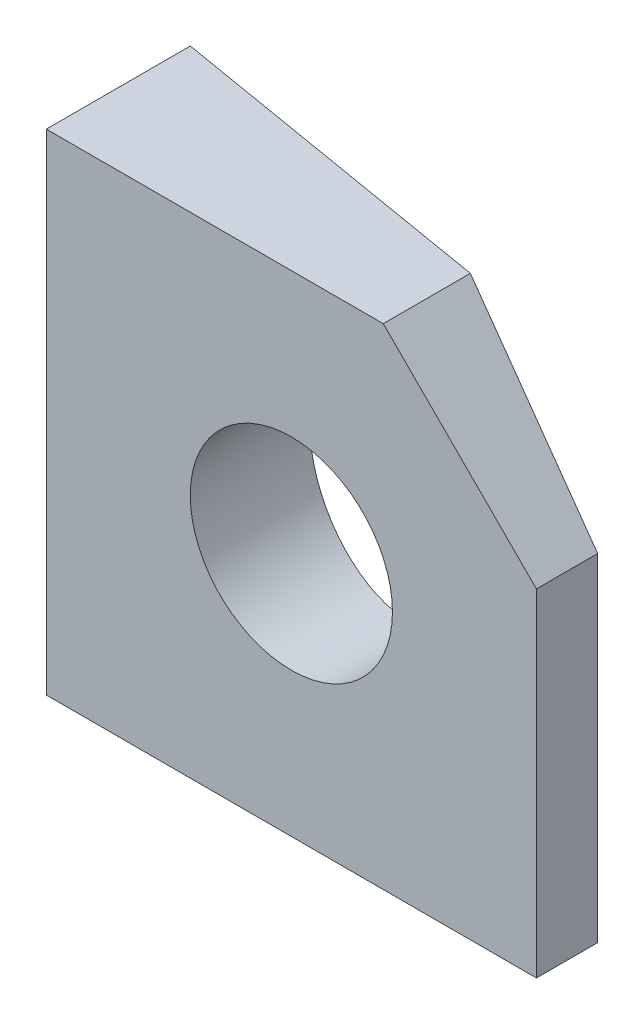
SolidWorks part; units mm, degrees
ref_plane "Front" through (0, 0, 0) normal (0, 0, 1) x (1, 0, 0)
ref_plane "Top" through (0, 0, 0) normal (0, 1, 0) x (1, 0, 0)
ref_plane "Right" through (0, 0, 0) normal (1, 0, 0) x (0, 0, -1)
other "Configuration Table"
sketch "Sketch1" plane through (0, 0, 0) normal (0, 0, 1) x (1, 0, 0)
  line L1 (8, 8) -> (-8, 8)
  line L2 (-8, 8) -> (-8, -8)
  line L3 (-8, -8) -> (8, -8)
  line L4 (8, -8) -> (8, 8)
  circle A0 centre (0, 0) radius 8 construction
  circle A1 centre (0, 0) radius 3.3
  dimension "d" = 6.6
  dimension "B" = 16
extrude "Base-Extrude" add sketch "Sketch1" against normal blind 4.7
sketch "Sketch2" plane through (-0.2147, 8, -3.4984) normal (0, 1, 0) x (-1, 0, 0)
  line L0 (-8.2147, -1.2016) -> (7.7853, -1.2016)
  line L1 (7.7853, -1.2016) -> (-8.2147, 1.4984)
  line L3 (-8.2147, 1.4984) -> (-8.2147, -1.2016)
  dimension "H" = 2
extrude "Cut-Extrude1" cut sketch "Sketch2" against normal through all
chamfer "Chamfer1" distance 5 angle 45 1 edges at (8, 8, -1)
